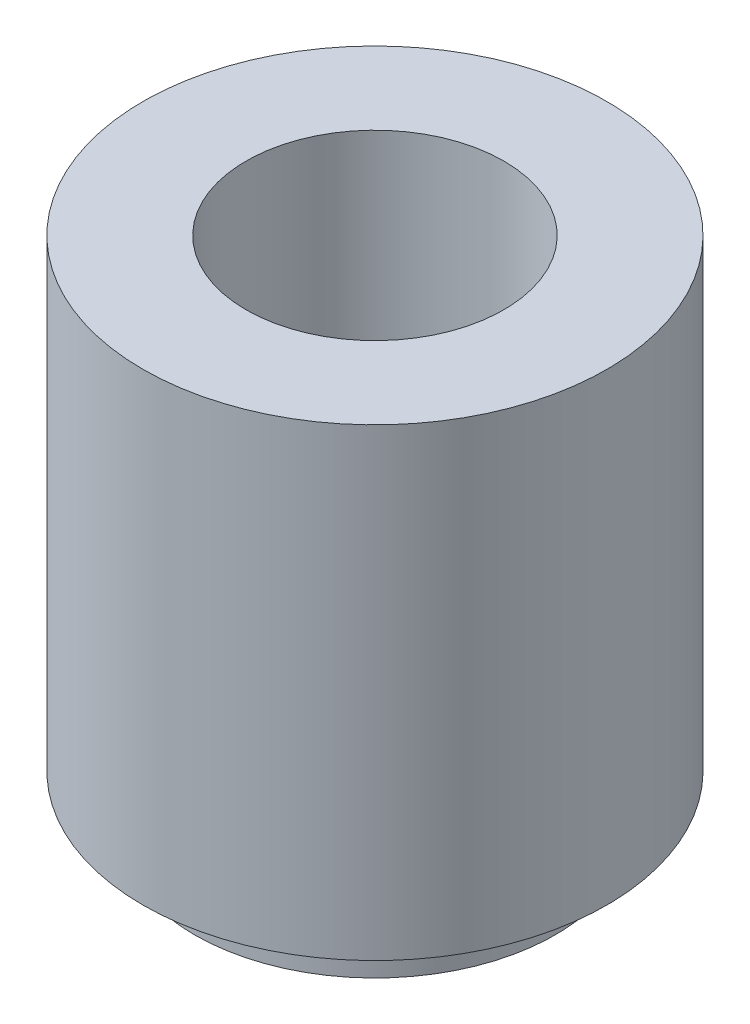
SolidWorks part; units mm, degrees
ref_plane "Plan de face" through (0, 0, 0) normal (0, 0, 1) x (1, 0, 0)
ref_plane "Plan de dessus" through (0, 0, 0) normal (0, 1, 0) x (1, 0, 0)
ref_plane "Plan de droite" through (0, 0, 0) normal (1, 0, 0) x (0, 0, -1)
ref_plane "Plan1" through (0, 0, 0) normal (0, 0, -1) x (-1, 0, 0)
sketch "Esquisse1" plane through (0, 0, 0) normal (0, 0, -1) x (-1, 0, 0)
  line L0 (-3.5, -4) -> (-3.5, -5)
  line L1 (-3.5, -5) -> (-2.5, -5)
  line L2 (-2.5, -5) -> (-2.5, 5)
  line L3 (-2.5, 5) -> (-4.5, 5)
  line L4 (-4.5, 5) -> (-4.5, -4)
  line L5 (-4.5, -4) -> (-3.5, -4)
  line L6 (0, -5) -> (0, 5) construction
revolve "Révolution1" add sketch "Esquisse1" angle 360 about L6
